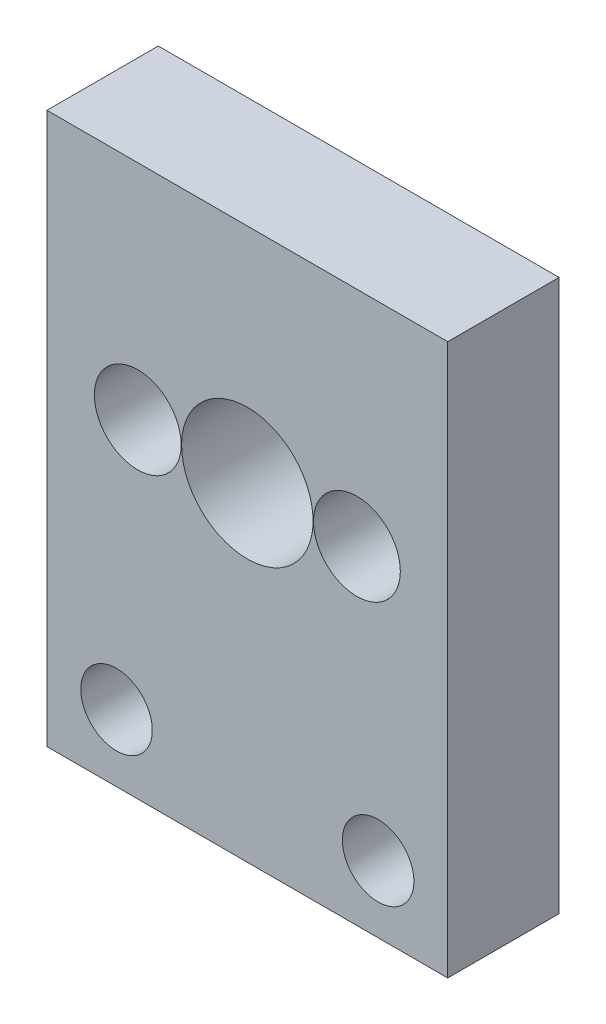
SolidWorks part; units mm, degrees
ref_plane "Front" through (0, 0, 0) normal (0, 0, 1) x (1, 0, 0)
ref_plane "Top" through (0, 0, 0) normal (0, 1, 0) x (1, 0, 0)
ref_plane "Right" through (0, 0, 0) normal (1, 0, 0) x (0, 0, -1)
sketch "Sketch1" plane through (0, 0, 0) normal (0, 0, 1) x (1, 0, 0)
  line L1 (-9.144, 10.16) -> (9.144, 10.16)
  line L2 (-9.144, 10.16) -> (-9.144, -14.986)
  line L3 (-9.144, -14.986) -> (9.144, -14.986)
  line L4 (9.144, 10.16) -> (9.144, -14.986)
  point P4 (0, -14.986)
  dimension "D1" = 18.288
  dimension "D2" = 14.986
  dimension "D3" = 10.16
extrude "Extrude1" add sketch "Sketch1" along normal blind 5.08
sketch "Sketch2" plane through (0, 0, 0) normal (0, 0, -1) x (-1, 0, 0)
  circle A0 centre (0, 0) radius 3
  dimension "D1" = 6
extrude "Cut-Extrude1" cut sketch "Sketch2" against normal through all
hole_wizard "CBORE for M2 SHCS1" positions "Sketch4" profile "Sketch3" counterbore size "M2" standard "Ansi Metric"
sketch "Sketch4" plane through (0, 0, 5.08) normal (0, 0, 1) x (1, 0, 0)
  line L0 (-5, 0) -> (5, 0) construction
  point P0 (5, 0)
  point P1 (-5, 0)
  dimension "D1" = 10
sketch "Sketch3" plane through (5, 0, 5.08) normal (1, 0, 0) x (0, -1, 0)
  line L0 (0, 0) -> (0, 5.08)
  line L1 (0, 5.08) -> (1.05, 5.08)
  line L3 (1.05, 5.08) -> (1.05, 3.1)
  line L4 (1.05, 3.1) -> (1.9812, 3.1)
  line L5 (1.9812, 3.1) -> (1.9812, 0)
  line L7 (1.9812, 0) -> (0, 0)
  line L11 (0, -6.35) -> (0, 39.0469) construction
  dimension "Thru Hole Dia." = 2.1
  dimension "Thru Hole Depth" = 5.08
  dimension "C'Bore Dia." = 3.9624
  dimension "C'Bore Depth" = 3.1
hole_wizard "#30 (0.128500) Diameter Hole1" positions "Sketch6" profile "Sketch5" hole size "#30" standard "Ansi Inch"
sketch "Sketch6" plane through (0, 0, 0) normal (0, 0, -1) x (-1, 0, 0)
  line L0 (9.144, -14.986) -> (-9.144, -14.986) construction
  line L1 (-9.144, -14.986) -> (-9.144, 10.16) construction
  line L2 (9.144, 10.16) -> (9.144, -14.986) construction
  point P0 (-5.969, -11.938)
  point P1 (5.969, -11.938)
  dimension "D1" = 3.048
  dimension "D2" = 3.175
  dimension "D3" = 3.175
sketch "Sketch5" plane through (5.969, -11.938, 0) normal (1, 0, 0) x (0, 1, 0)
  line L0 (0, 0) -> (0, 5.08)
  line L1 (0, 5.08) -> (1.6319, 5.08)
  line L2 (1.6319, 5.08) -> (1.6319, 0)
  line L5 (1.6319, 0) -> (0, 0)
  line L11 (0, -6.35) -> (0, 107.95) construction
  dimension "Thru Hole Dia." = 3.2639
  dimension "Thru Hole Depth" = 5.08
